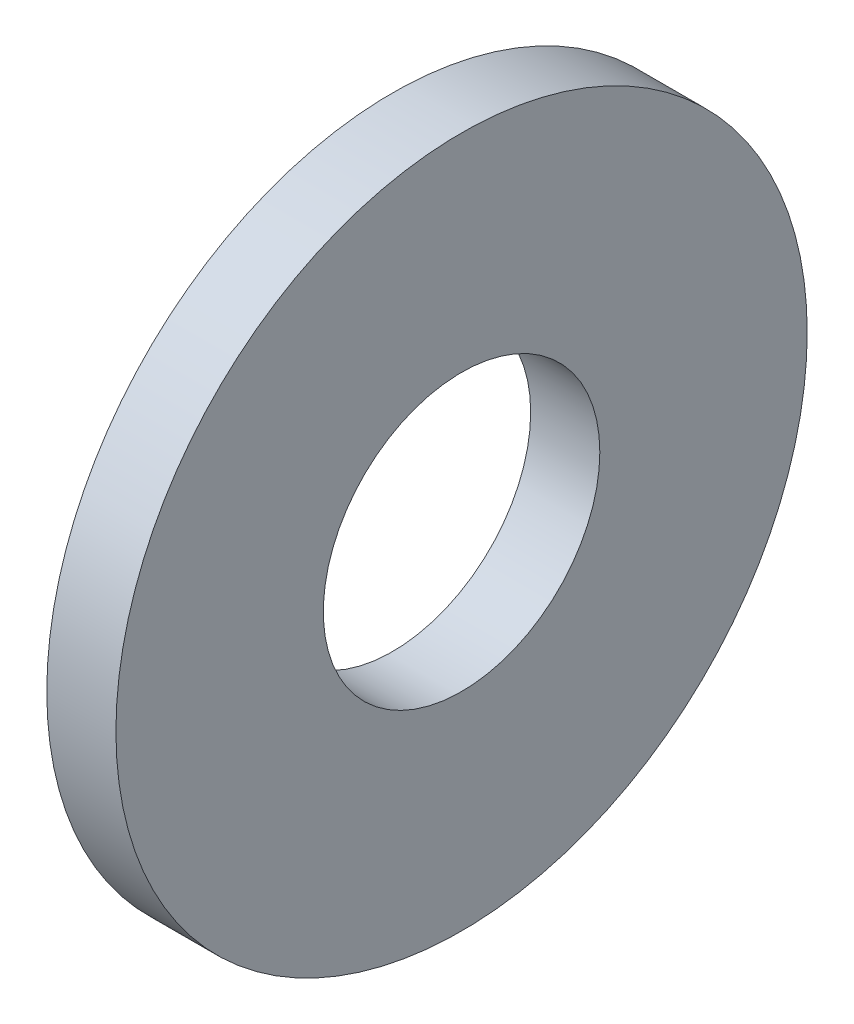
SolidWorks part; units mm, degrees
ref_plane "Plane1" through (0, 0, 0) normal (0, 0, 1) x (1, 0, 0)
ref_plane "Plane2" through (0, 0, 0) normal (0, 1, 0) x (1, 0, 0)
ref_plane "Plane3" through (0, 0, 0) normal (1, 0, 0) x (0, 0, -1)
extrude "Base-Extrude" add sketch "Sketch1" along normal blind 1
sketch "Sketch1" plane through (0, 0, 0) normal (1, 0, 0) x (0, 0, -1)
  circle A0 centre (0, 0) radius 2
  circle A1 centre (0, 0) radius 5
  dimension "Insid_dia" = 4
  dimension "OutsideDia" = 10
